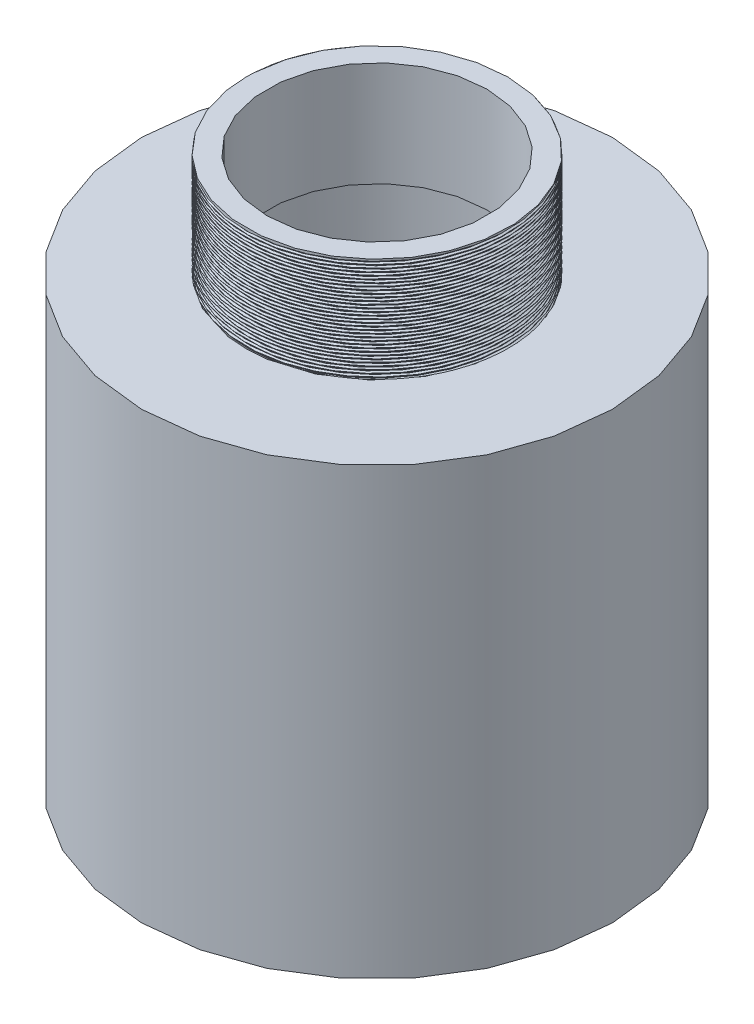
SolidWorks part; units mm, degrees
ref_plane "Front" through (0, 0, 0) normal (0, 0, 1) x (1, 0, 0)
ref_plane "Top" through (0, 0, 0) normal (0, 1, 0) x (1, 0, 0)
ref_plane "Right" through (0, 0, 0) normal (1, 0, 0) x (0, 0, -1)
sketch "Sketch1" plane through (0, 0, 0) normal (0, 1, 0) x (1, 0, 0)
  circle A0 centre (0, 0) radius 22.5
  dimension "D1" = 45
extrude "Boss-Extrude1" add sketch "Sketch1" along normal blind 42.5
sketch "Sketch2" plane through (0, 0, 0) normal (0, -1, 0) x (1, 0, 0)
  circle A0 centre (0, 0) radius 12.5
  dimension "D1" = 25
extrude "Cut-Extrude1" cut sketch "Sketch2" against normal up to surface (42.5 mm away)
thread "Thread1" pitch 0.3 start angle 0, offset 0, length 10, pitch 0.3, diameter 25
ref_plane "Plane1" through (12.5, 0, 0) normal (0, 0, 1) x (1, 0, 0)
sketch "Thread Profile1" plane through (12.5, 0, 0) normal (0, 0, 1) x (1, 0, 0)
  line L0 (0, 0) -> (0, 0.3) construction
  line L11 (0, 0) -> (0, 0.2625)
  line L12 (0, 0.2625) -> (-0.1624, 0.1687)
  line L13 (-0.1624, 0.1687) -> (-0.1624, 0.0937)
  line L15 (-0.1624, 0.0937) -> (0, 0)
  line L17 (-0.1624, 0.1312) -> (0, 0.1312) construction
  point P2 (0, 0)
  dimension "Pitch" = 0.3
  dimension "Profile_Angle" = 60
  dimension "Profile_Land" = 0.075
  dimension "Profile_Height" = 0.1624
sketch "Sketch5" plane through (0, 0, 0) normal (0, -1, 0) x (1, 0, 0)
  line L0 (-12.5, 0) -> (12.5, 0) construction
  line L1 (22.5, 0) -> (12.5, 0) construction
  line L2 (-12.5, 0) -> (-22.5, 0) construction
  circle A0 centre (0, 0) radius 22.5 construction
  circle A1 centre (-17.5, 0) radius 2.5
  circle A2 centre (17.5, 0) radius 2.5
  point P6 (0, 0)
  dimension "D1" = 5
extrude "Cut-Extrude2" cut sketch "Sketch5" against normal blind 20
sketch "Sketch6" plane through (0, 42.5, 0) normal (0, 1, 0) x (1, 0, 0)
  circle A3 centre (0, 0) radius 10.5
  circle A4 centre (0, 0) radius 10.5
  dimension "D1" = 2
extrude "Extrude-Thin1" add sketch "Sketch6" along normal blind 10 thin
thread "Thread2" pitch 0.3 start angle 0, offset 0, length 10, pitch 0.3, diameter 25
ref_plane "Plane2" through (-12.5, 52.5, 0) normal (0, 0, 1) x (-1, 0, 0)
sketch "Thread Profile2" plane through (-12.5, 52.5, 0) normal (0, 0, 1) x (-1, 0, 0)
  line L0 (0, 0) -> (0, 0.3) construction
  line L11 (0, 0) -> (0, 0.2625)
  line L12 (0, 0.2625) -> (-0.1624, 0.1687)
  line L13 (-0.1624, 0.1687) -> (-0.1624, 0.0937)
  line L15 (-0.1624, 0.0937) -> (0, 0)
  line L17 (-0.1624, 0.1312) -> (0, 0.1312) construction
  point P2 (0, 0)
  dimension "Pitch" = 0.3
  dimension "Profile_Angle" = 60
  dimension "Profile_Land" = 0.075
  dimension "Profile_Height" = 0.1624
